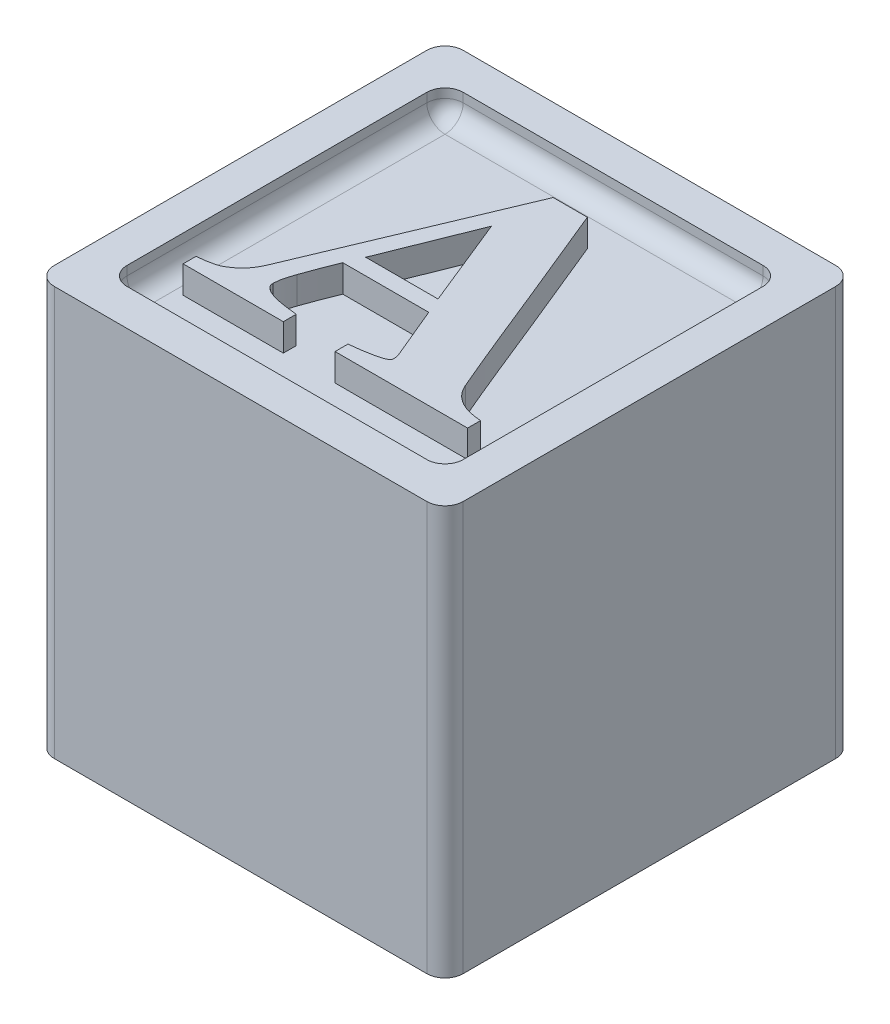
SolidWorks part; units mm, degrees
ref_plane "Front" through (0, 0, 0) normal (0, 0, 1) x (1, 0, 0)
ref_plane "Top" through (0, 0, 0) normal (0, 1, 0) x (1, 0, 0)
ref_plane "Right" through (0, 0, 0) normal (1, 0, 0) x (0, 0, -1)
sketch "Sketch1" plane through (0, 0, 0) normal (0, 1, 0) x (1, 0, 0)
  line L1 (0, 0) -> (45, 0)
  line L2 (0, 0) -> (0, 45)
  line L3 (0, 45) -> (45, 45)
  line L4 (45, 0) -> (45, 45)
  dimension "D1" = 45
extrude "Boss-Extrude1" add sketch "Sketch1" along normal blind 45
sketch "Sketch2" plane through (0, 45, 0) normal (0, 1, 0) x (1, 0, 0)
  line L0 (0, 0) -> (4, 4) construction
  line L1 (6, 41) -> (39, 41)
  line L2 (4, 39) -> (4, 6)
  line L3 (6, 4) -> (39, 4)
  line L4 (41, 39) -> (41, 6)
  line L5 (41, 41) -> (45, 45) construction
  line L6 (0, 45) -> (0, 0) construction
  arc A0 (39, 41) -> (41, 39) centre (39, 39) cw
  arc A1 (39, 4) -> (41, 6) centre (39, 6) ccw
  arc A2 (4, 6) -> (6, 4) centre (6, 6) ccw
  arc A3 (6, 41) -> (4, 39) centre (6, 39) ccw
  dimension "D2" = 2
  dimension "D1" = 4
extrude "Cut-Extrude1" cut sketch "Sketch2" against normal blind 3
fillet "Fillet1" radius 2 8 edges at (41, 42, -22.5) (40.4142, 42, -4.5858) (22.5, 42, -4) (4.5858, 42, -4.5858) (4, 42, -22.5) (4.5858, 42, -40.4142) (22.5, 42, -41) (40.4142, 42, -40.4142)
sketch "Sketch3" plane through (0, 42, 0) normal (0, 1, 0) x (1, 0, 0)
  line L0 (8.0028, 9.2432) -> (36.562, 9.2432) construction
  text T0 "A" font "Georgia" height in points 100
extrude "Boss-Extrude2" add sketch "Sketch3" along normal blind 3
fillet "Fillet2" radius 2 3 edges at (45, 22.5, -45) (45, 22.5, 0) (0, 22.5, 0)
fillet "Fillet3" radius 2 1 edges at (0, 22.5, -45)
sketch3d "URDF Reference"
  line L0 (0, 0, 0) -> (10, 0, 0) construction
  line L1 (0, 0, 0) -> (0, 0, -10) construction
  point P0 (0, 0, 0)
